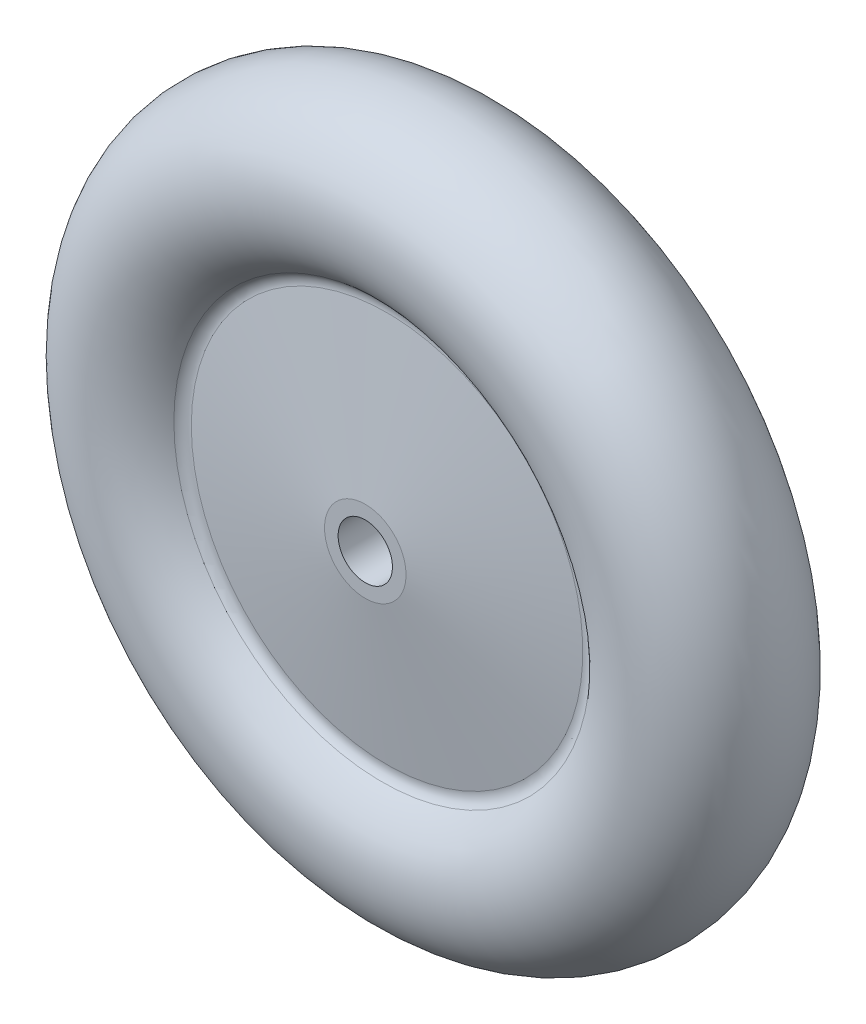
SolidWorks part; units mm, degrees
ref_plane "Front" through (0, 0, 0) normal (0, 0, 1) x (1, 0, 0)
ref_plane "Top" through (0, 0, 0) normal (0, 1, 0) x (1, 0, 0)
ref_plane "Right" through (0, 0, 0) normal (1, 0, 0) x (0, 0, -1)
sketch "Sketch1" plane through (0, 0, 0) normal (1, 0, 0) x (0, 0, -1)
  line L0 (4.3875, 14.5456) -> (0, 14.5456) construction
  line L1 (18.1622, 0) -> (0, 0) construction
  line L2 (5, 2) -> (-5, 2)
  line L3 (5, 2) -> (5, 3)
  line L4 (-5, 2) -> (-5, 3)
  line L5 (-5, 3) -> (-3.3972, 14.4065)
  line L6 (5, 3) -> (3.3972, 14.4065)
  line L8 (0, 0) -> (0, 29.6557) construction
  line L9 (18.1622, 0) -> (-17.139, 0) construction
  line L11 (18.1622, 2) -> (-17.139, 2) construction
  arc A0 (3.7607, 15.3248) -> (3.3972, 14.4065) centre (4.3875, 14.5456) ccw
  arc A1 (3.7607, 15.3248) -> (-3.7607, 15.3248) centre (0, 20) ccw
  arc A2 (-3.7607, 15.3248) -> (-3.3972, 14.4065) centre (-4.3875, 14.5456) cw
  point P10 (0, 2)
  dimension "D1" = 6
  dimension "D9" = 1
  dimension "D2" = 20
  dimension "D3" = 14.5456
  dimension "D4" = 2
  dimension "D5" = 5
  dimension "D6" = 1
revolve "Revolve1" add sketch "Sketch1" angle 360 about L1
